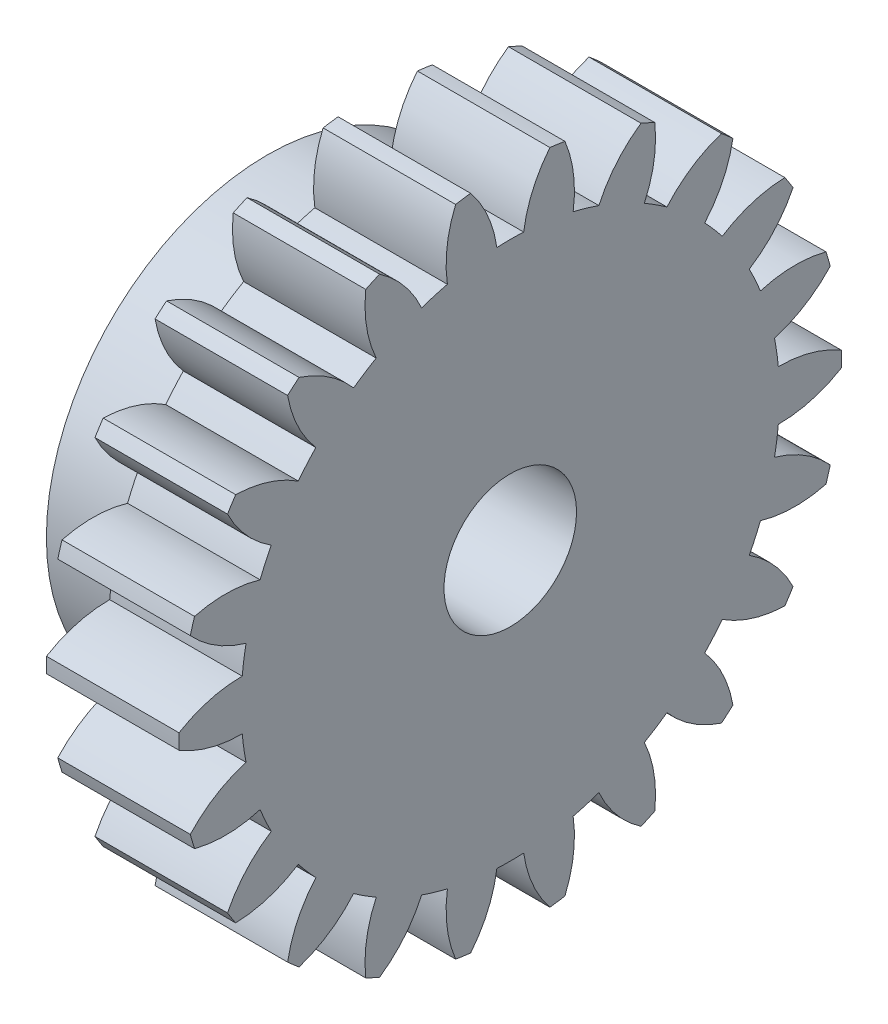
SolidWorks part; units mm, degrees
ref_plane "Front Plane" through (0, 0, 0) normal (0, 0, 1) x (1, 0, 0)
ref_plane "Top Plane" through (0, 0, 0) normal (0, 1, 0) x (1, 0, 0)
ref_plane "Right Plane" through (0, 0, 0) normal (1, 0, 0) x (0, 0, -1)
sketch "Sketch1" plane through (0, 0, 0) normal (1, 0, 0) x (0, 0, -1)
  circle A0 centre (0, 0) radius 30
  dimension "D1" = 60
extrude "Boss-Extrude1" add sketch "Sketch1" along normal blind 12
sketch "Sketch2" plane through (12, 0, 0) normal (1, 0, 0) x (0, 0, -1)
  line L0 (0, 0) -> (0, 67.3847) construction
  line L3 (-2.114, 27.4186) -> (-3.9052, 27.1611) construction
  arc A0 (1.2153, 24.3437) -> (-1.2153, 24.3437) centre (0, 0) ccw
  arc A1 (3.6084, 29.8078) -> (-3.6084, 29.8078) centre (0, 0) ccw
  circle A2 centre (0, 0) radius 27.5 construction
  circle A3 centre (0, 0) radius 25.8415 construction
  arc A4 (-1.2153, 24.3437) -> (-3.6084, 29.8078) centre (-12.1104, 22.8281) ccw
  arc A5 (3.6084, 29.8078) -> (1.2153, 24.3437) centre (12.1104, 22.8281) ccw
  dimension "D1" = 48.748
  dimension "D2" = 60.0508
  dimension "D3" = 55
  dimension "D6" = 51.6831
  dimension "D7" = 11
  dimension "D4" = 7.2167
extrude "Cut-Extrude1" cut sketch "Sketch2" against normal blind 12 contours A1 A4 A0 A5
pattern_circular "CirPattern1" count 22 over 360 about axis through (0, 0, 0) along (1, 0, 0) of "Cut-Extrude1"
sketch "Sketch4" plane through (0, 0, 0) normal (-1, 0, 0) x (0, 0, 1)
  circle A0 centre (0, 0) radius 20
  dimension "D1" = 40
extrude "Boss-Extrude2" add sketch "Sketch4" along normal blind 10
sketch "Sketch5" plane through (12, 0, 0) normal (1, 0, 0) x (0, 0, -1)
  circle A0 centre (0, 0) radius 6
  dimension "D1" = 12
extrude "Cut-Extrude2" cut sketch "Sketch5" against normal through all
